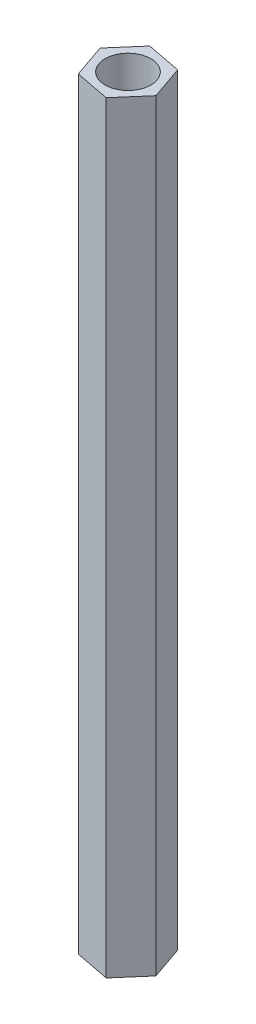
SolidWorks part; units mm, degrees
ref_plane "Front Plane" through (0, 0, 0) normal (0, 0, 1) x (1, 0, 0)
ref_plane "Top Plane" through (0, 0, 0) normal (0, 1, 0) x (1, 0, 0)
ref_plane "Right Plane" through (0, 0, 0) normal (1, 0, 0) x (0, 0, -1)
sketch "Sketch1" plane through (0, 0, 0) normal (0, 1, 0) x (1, 0, 0)
  line L1 (0.755, -2.1825) -> (2.2676, -0.4374)
  line L2 (2.2676, -0.4374) -> (1.5126, 1.7451)
  line L3 (1.5126, 1.7451) -> (-0.755, 2.1825)
  line L4 (-0.755, 2.1825) -> (-2.2676, 0.4374)
  line L5 (-2.2676, 0.4374) -> (-1.5126, -1.7451)
  line L6 (-1.5126, -1.7451) -> (0.755, -2.1825)
  circle A0 centre (0, 0) radius 2 construction
  circle A1 centre (0, 0) radius 1.5
extrude "Boss-Extrude1" add sketch "Sketch1" along normal blind 50
